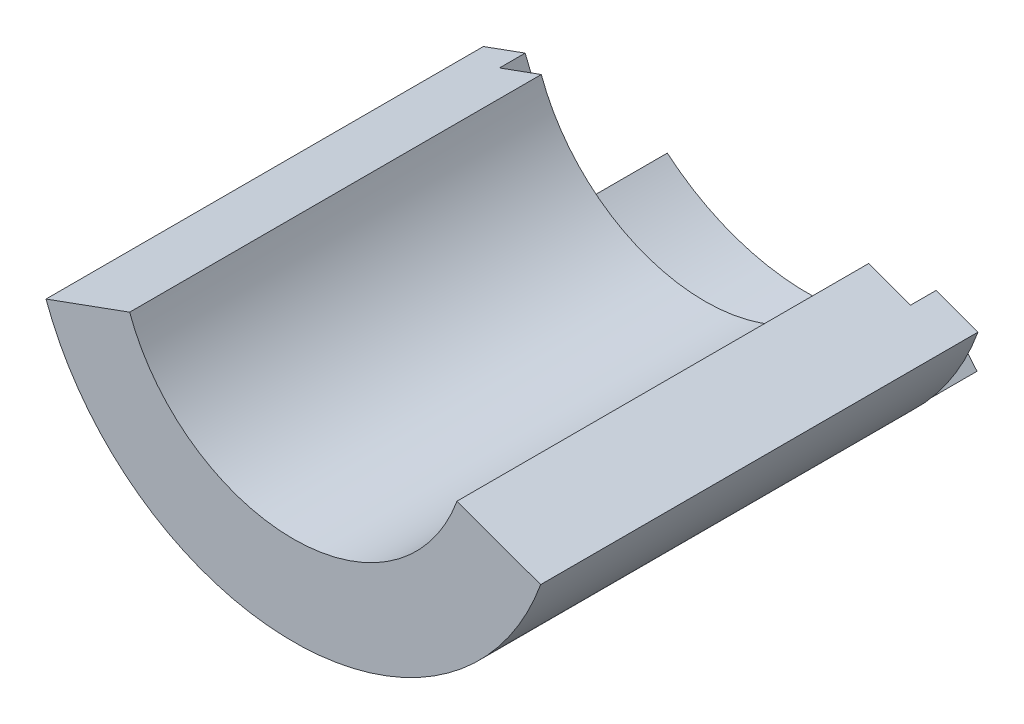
SolidWorks part; units mm, degrees
ref_plane "Front Plane" through (0, 0, 0) normal (0, 0, 1) x (1, 0, 0)
ref_plane "Top Plane" through (0, 0, 0) normal (0, 1, 0) x (1, 0, 0)
ref_plane "Right Plane" through (0, 0, 0) normal (1, 0, 0) x (0, 0, -1)
sketch "Sketch1" plane through (0, 0, 0) normal (0, 0, 1) x (1, 0, 0)
  line L0 (15.5391, 0) -> (-22.4453, 0) construction
  line L1 (-4.3517, -5.1861) -> (-6.5757, -7.8366)
  line L2 (4.3517, -5.1861) -> (6.5757, -7.8366)
  arc A0 (-5.4637, -6.5114) -> (5.4637, -6.5114) centre (0, 0) ccw construction
  arc A1 (-4.3517, -5.1861) -> (4.3517, -5.1861) centre (0, 0) ccw
  arc A2 (-6.5757, -7.8366) -> (6.5757, -7.8366) centre (0, 0) ccw
  dimension "D1" = 17
  dimension "D2" = 13.54
  dimension "D3" = 3.46
  dimension "D4" = 50
  dimension "D5" = 50
extrude "Boss-Extrude1" add sketch "Sketch1" along normal blind 3
sketch "Sketch2" plane through (0, 0, 3) normal (0, 0, 1) x (1, 0, 0)
  line L0 (12.7034, 0) -> (-13.6621, 0) construction
  line L1 (-6.3617, -2.3155) -> (-9.6131, -3.4989)
  line L2 (6.3617, -2.3155) -> (9.6131, -3.4989)
  arc A0 (-9.6131, -3.4989) -> (9.6131, -3.4989) centre (0, 0) ccw
  arc A1 (-6.5757, -7.8366) -> (6.5757, -7.8366) centre (0, 0) ccw construction
  arc A2 (-6.3617, -2.3155) -> (6.3617, -2.3155) centre (0, 0) ccw
  arc A3 (-4.3517, -5.1861) -> (4.3517, -5.1861) centre (0, 0) ccw construction
  dimension "D1" = 20
  dimension "D2" = 20
extrude "Boss-Extrude2" add sketch "Sketch2" along normal blind 17
sketch "Sketch3" plane through (0, 0, 3) normal (0, 0, -1) x (-1, 0, 0)
  circle A0 centre (0, 0) radius 8.5
  dimension "D1" = 17
extrude "Cut-Extrude2" cut sketch "Sketch3" against normal blind 1 and the other way blind 3
